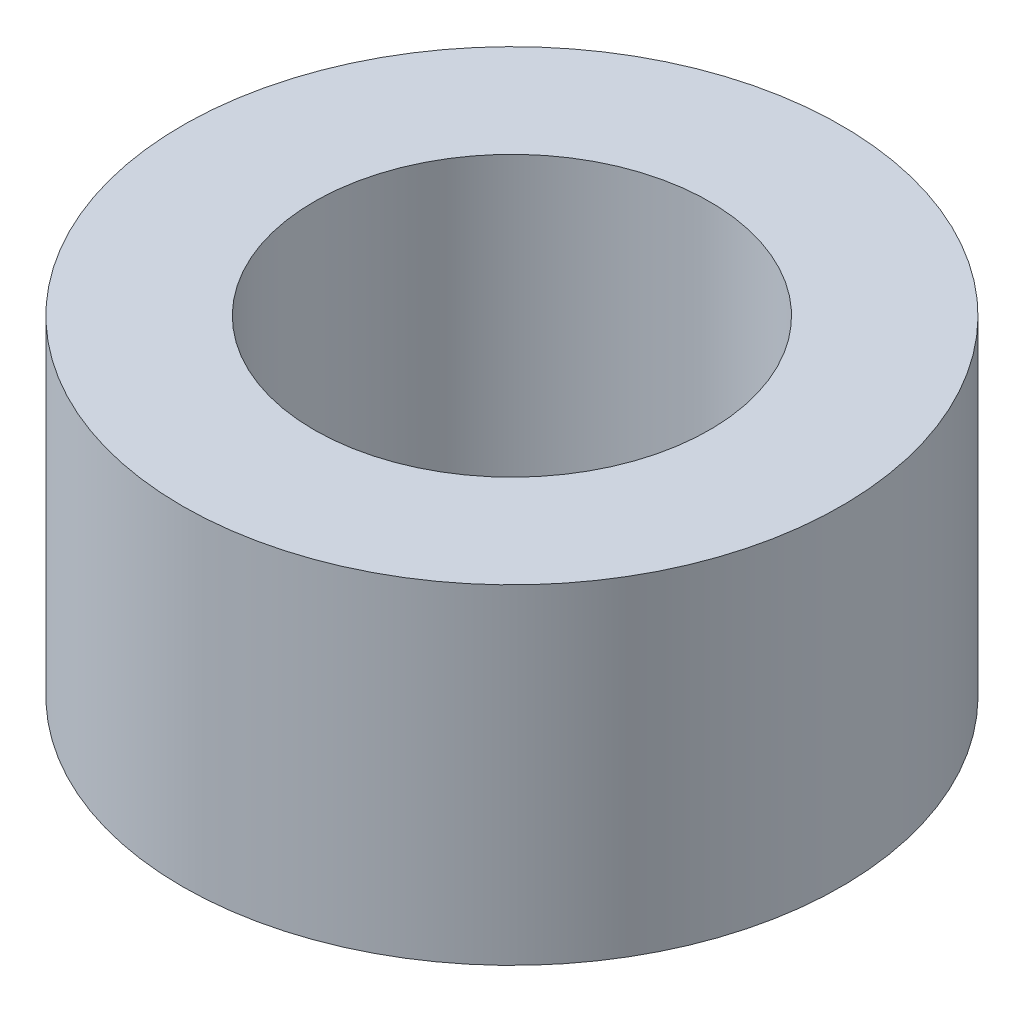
SolidWorks part; units mm, degrees
ref_plane "Front Plane" through (0, 0, 0) normal (0, 0, 1) x (1, 0, 0)
ref_plane "Top Plane" through (0, 0, 0) normal (0, 1, 0) x (1, 0, 0)
ref_plane "Right Plane" through (0, 0, 0) normal (1, 0, 0) x (0, 0, -1)
sketch "Sketch1" plane through (0, 0, 0) normal (0, 1, 0) x (1, 0, 0)
  circle A0 centre (0, 0) radius 3.81
  circle A1 centre (0, 0) radius 6.35
  dimension "D1" = 7.62
  dimension "D2" = 12.7
extrude "Extrude1" add sketch "Sketch1" along normal blind 6.35
